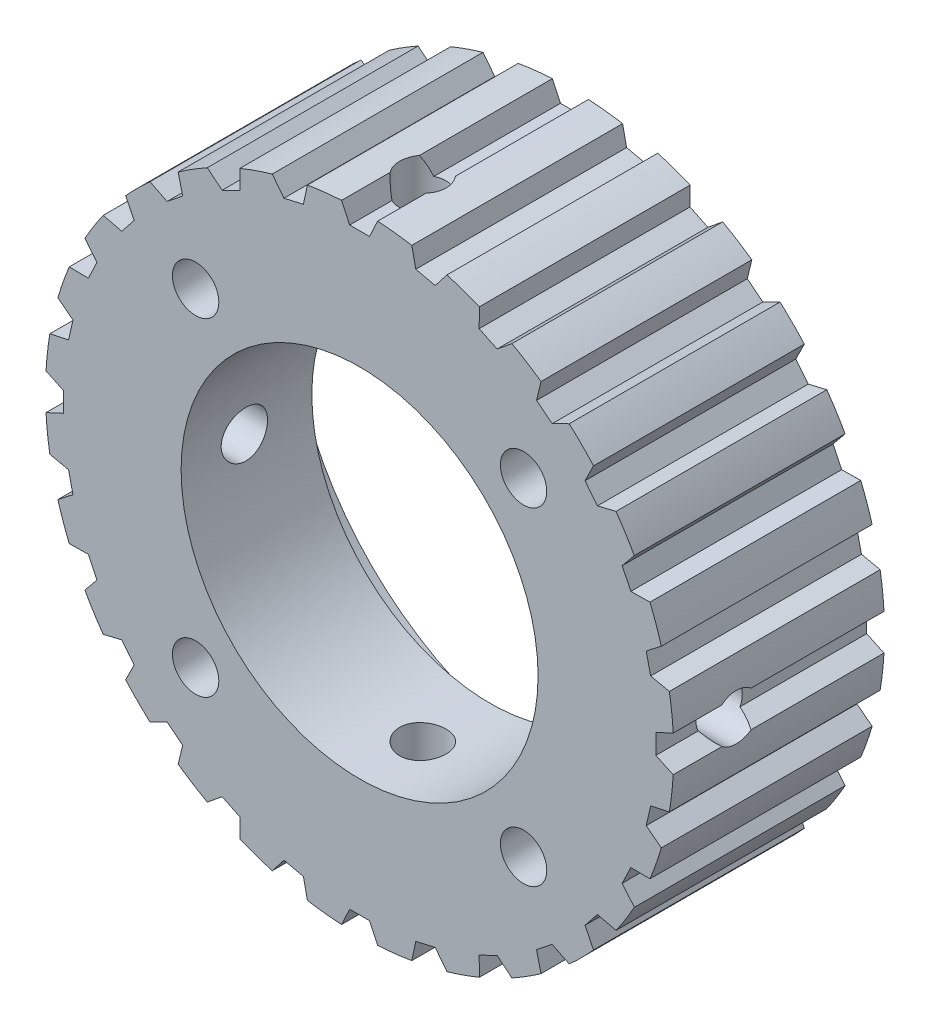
SolidWorks part; units mm, degrees
ref_plane "Front Plane" through (0, 0, 0) normal (0, 0, 1) x (1, 0, 0)
ref_plane "Top Plane" through (0, 0, 0) normal (0, 1, 0) x (1, 0, 0)
ref_plane "Right Plane" through (0, 0, 0) normal (1, 0, 0) x (0, 0, -1)
ref_plane "Plane1" through (0, 0, 0) normal (0, -1, 0) x (1, 0, 0)
sketch "Sketch1" plane through (0, 0, 0) normal (0, -1, 0) x (1, 0, 0)
  line L0 (22.35, 15) -> (0, 15)
  line L1 (0, 15) -> (0, 0)
  line L2 (0, 0) -> (22.35, 0)
  line L3 (22.35, 0) -> (22.35, 15)
  line L4 (0, 15) -> (0, 0) construction
revolve "Revolve1" add sketch "Sketch1" angle 360 about L4
sketch "Sketch2" plane through (0, 0, 15) normal (0, 0, 1) x (1, 0, 0)
  line L0 (8.5255, 20.6601) -> (8.5086, 19.2995)
  line L1 (8.5086, 19.2995) -> (10.5043, 19.2746)
  line L2 (10.5043, 19.2746) -> (10.8371, 19.5469)
  arc A0 (10.8371, 19.5469) -> (8.5255, 20.6601) centre (0, 0) ccw
extrude "Cut-Extrude1" cut sketch "Sketch2" against normal through all
sketch "Sketch3" plane through (0, 0, 15) normal (0, 0, 1) x (1, 0, 0)
  line L0 (12.9091, 18.245) -> (12.5898, 16.9223)
  line L1 (12.5898, 16.9223) -> (13.6965, 16.0397)
  line L2 (13.6965, 16.0397) -> (14.915, 16.6453)
  arc A0 (14.915, 16.6453) -> (12.9091, 18.245) centre (0, 0) ccw
extrude "Cut-Extrude2" cut sketch "Sketch3" against normal through all
sketch "Sketch4" plane through (0, 0, 15) normal (0, 0, 1) x (1, 0, 0)
  line L0 (16.6453, 14.915) -> (16.0397, 13.6965)
  line L1 (16.0397, 13.6965) -> (16.9223, 12.5898)
  line L2 (16.9223, 12.5898) -> (18.245, 12.9091)
  arc A0 (18.245, 12.9091) -> (16.6453, 14.915) centre (0, 0) ccw
extrude "Cut-Extrude3" cut sketch "Sketch4" against normal through all
sketch "Sketch5" plane through (0, 0, 15) normal (0, 0, 1) x (1, 0, 0)
  line L0 (19.5469, 10.8371) -> (19.2746, 10.5043)
  line L1 (19.2746, 10.5043) -> (19.2995, 8.5086)
  line L2 (19.2995, 8.5086) -> (20.6601, 8.5255)
  arc A0 (20.6601, 8.5255) -> (19.5469, 10.8371) centre (0, 0) ccw
extrude "Cut-Extrude4" cut sketch "Sketch5" against normal through all
sketch "Sketch6" plane through (0, 0, 15) normal (0, 0, 1) x (1, 0, 0)
  line L0 (21.4683, 6.2158) -> (20.394, 5.3808)
  line L1 (20.394, 5.3808) -> (20.709, 4.0007)
  line L2 (20.709, 4.0007) -> (22.0392, 3.7145)
  arc A0 (22.0392, 3.7145) -> (21.4683, 6.2158) centre (0, 0) ccw
extrude "Cut-Extrude5" cut sketch "Sketch6" against normal through all
sketch "Sketch7" plane through (0, 0, 15) normal (0, 0, 1) x (1, 0, 0)
  line L0 (22.3132, 1.2828) -> (21.08, 0.7078)
  line L1 (21.08, 0.7078) -> (21.08, -0.7078)
  line L2 (21.08, -0.7078) -> (22.3132, -1.2828)
  arc A0 (22.3132, -1.2828) -> (22.3132, 1.2828) centre (0, 0) ccw
extrude "Cut-Extrude6" cut sketch "Sketch7" against normal through all
sketch "Sketch8" plane through (0, 0, 15) normal (0, 0, 1) x (1, 0, 0)
  line L0 (22.0392, -3.7145) -> (20.709, -4.0007)
  line L1 (20.709, -4.0007) -> (20.394, -5.3808)
  line L2 (20.394, -5.3808) -> (21.4683, -6.2158)
  arc A0 (21.4683, -6.2158) -> (22.0392, -3.7145) centre (0, 0) ccw
extrude "Cut-Extrude7" cut sketch "Sketch8" against normal through all
sketch "Sketch9" plane through (0, 0, 15) normal (0, 0, 1) x (1, 0, 0)
  line L0 (20.6601, -8.5255) -> (19.2995, -8.5086)
  line L1 (19.2995, -8.5086) -> (19.2746, -10.5043)
  line L2 (19.2746, -10.5043) -> (19.5469, -10.8371)
  arc A0 (19.5469, -10.8371) -> (20.6601, -8.5255) centre (0, 0) ccw
extrude "Cut-Extrude8" cut sketch "Sketch9" against normal through all
sketch "Sketch10" plane through (0, 0, 15) normal (0, 0, 1) x (1, 0, 0)
  line L0 (18.245, -12.9091) -> (16.9223, -12.5898)
  line L1 (16.9223, -12.5898) -> (16.0397, -13.6965)
  line L2 (16.0397, -13.6965) -> (16.6453, -14.915)
  arc A0 (16.6453, -14.915) -> (18.245, -12.9091) centre (0, 0) ccw
extrude "Cut-Extrude9" cut sketch "Sketch10" against normal through all
sketch "Sketch11" plane through (0, 0, 15) normal (0, 0, 1) x (1, 0, 0)
  line L0 (14.915, -16.6453) -> (13.6965, -16.0397)
  line L1 (13.6965, -16.0397) -> (12.5898, -16.9223)
  line L2 (12.5898, -16.9223) -> (12.9091, -18.245)
  arc A0 (12.9091, -18.245) -> (14.915, -16.6453) centre (0, 0) ccw
extrude "Cut-Extrude10" cut sketch "Sketch11" against normal through all
sketch "Sketch12" plane through (0, 0, 15) normal (0, 0, 1) x (1, 0, 0)
  line L0 (10.8371, -19.5469) -> (10.5043, -19.2746)
  line L1 (10.5043, -19.2746) -> (8.5086, -19.2995)
  line L2 (8.5086, -19.2995) -> (8.5255, -20.6601)
  arc A0 (8.5255, -20.6601) -> (10.8371, -19.5469) centre (0, 0) ccw
extrude "Cut-Extrude11" cut sketch "Sketch12" against normal through all
sketch "Sketch13" plane through (0, 0, 15) normal (0, 0, 1) x (1, 0, 0)
  line L0 (6.2158, -21.4683) -> (5.3808, -20.394)
  line L1 (5.3808, -20.394) -> (4.0007, -20.709)
  line L2 (4.0007, -20.709) -> (3.7145, -22.0392)
  arc A0 (3.7145, -22.0392) -> (6.2158, -21.4683) centre (0, 0) ccw
extrude "Cut-Extrude12" cut sketch "Sketch13" against normal through all
sketch "Sketch14" plane through (0, 0, 15) normal (0, 0, 1) x (1, 0, 0)
  line L0 (1.2828, -22.3132) -> (0.7078, -21.08)
  line L1 (0.7078, -21.08) -> (-0.7078, -21.08)
  line L2 (-0.7078, -21.08) -> (-1.2828, -22.3132)
  arc A0 (-1.2828, -22.3132) -> (1.2828, -22.3132) centre (0, 0) ccw
extrude "Cut-Extrude13" cut sketch "Sketch14" against normal through all
sketch "Sketch15" plane through (0, 0, 15) normal (0, 0, 1) x (1, 0, 0)
  line L0 (-3.7145, -22.0392) -> (-4.0007, -20.709)
  line L1 (-4.0007, -20.709) -> (-5.3808, -20.394)
  line L2 (-5.3808, -20.394) -> (-6.2158, -21.4683)
  arc A0 (-6.2158, -21.4683) -> (-3.7145, -22.0392) centre (0, 0) ccw
extrude "Cut-Extrude14" cut sketch "Sketch15" against normal through all
sketch "Sketch16" plane through (0, 0, 15) normal (0, 0, 1) x (1, 0, 0)
  line L0 (-8.5255, -20.6601) -> (-8.5086, -19.2995)
  line L1 (-8.5086, -19.2995) -> (-10.5043, -19.2746)
  line L2 (-10.5043, -19.2746) -> (-10.8371, -19.5469)
  arc A0 (-10.8371, -19.5469) -> (-8.5255, -20.6601) centre (0, 0) ccw
extrude "Cut-Extrude15" cut sketch "Sketch16" against normal through all
sketch "Sketch17" plane through (0, 0, 15) normal (0, 0, 1) x (1, 0, 0)
  line L0 (-12.9091, -18.245) -> (-12.5898, -16.9223)
  line L1 (-12.5898, -16.9223) -> (-13.6965, -16.0397)
  line L2 (-13.6965, -16.0397) -> (-14.915, -16.6453)
  arc A0 (-14.915, -16.6453) -> (-12.9091, -18.245) centre (0, 0) ccw
extrude "Cut-Extrude16" cut sketch "Sketch17" against normal through all
sketch "Sketch18" plane through (0, 0, 15) normal (0, 0, 1) x (1, 0, 0)
  line L0 (-16.6453, -14.915) -> (-16.0397, -13.6965)
  line L1 (-16.0397, -13.6965) -> (-16.9223, -12.5898)
  line L2 (-16.9223, -12.5898) -> (-18.245, -12.9091)
  arc A0 (-18.245, -12.9091) -> (-16.6453, -14.915) centre (0, 0) ccw
extrude "Cut-Extrude17" cut sketch "Sketch18" against normal through all
sketch "Sketch19" plane through (0, 0, 15) normal (0, 0, 1) x (1, 0, 0)
  line L0 (-19.5469, -10.8371) -> (-19.2746, -10.5043)
  line L1 (-19.2746, -10.5043) -> (-19.2995, -8.5086)
  line L2 (-19.2995, -8.5086) -> (-20.6601, -8.5255)
  arc A0 (-20.6601, -8.5255) -> (-19.5469, -10.8371) centre (0, 0) ccw
extrude "Cut-Extrude18" cut sketch "Sketch19" against normal through all
sketch "Sketch20" plane through (0, 0, 15) normal (0, 0, 1) x (1, 0, 0)
  line L0 (-21.4683, -6.2158) -> (-20.394, -5.3808)
  line L1 (-20.394, -5.3808) -> (-20.709, -4.0007)
  line L2 (-20.709, -4.0007) -> (-22.0392, -3.7145)
  arc A0 (-22.0392, -3.7145) -> (-21.4683, -6.2158) centre (0, 0) ccw
extrude "Cut-Extrude19" cut sketch "Sketch20" against normal through all
sketch "Sketch21" plane through (0, 0, 15) normal (0, 0, 1) x (1, 0, 0)
  line L0 (-22.3132, -1.2828) -> (-21.08, -0.7078)
  line L1 (-21.08, -0.7078) -> (-21.08, 0.7078)
  line L2 (-21.08, 0.7078) -> (-22.3132, 1.2828)
  arc A0 (-22.3132, 1.2828) -> (-22.3132, -1.2828) centre (0, 0) ccw
extrude "Cut-Extrude20" cut sketch "Sketch21" against normal through all
sketch "Sketch22" plane through (0, 0, 15) normal (0, 0, 1) x (1, 0, 0)
  line L0 (-22.0392, 3.7145) -> (-20.709, 4.0007)
  line L1 (-20.709, 4.0007) -> (-20.394, 5.3808)
  line L2 (-20.394, 5.3808) -> (-21.4683, 6.2158)
  arc A0 (-21.4683, 6.2158) -> (-22.0392, 3.7145) centre (0, 0) ccw
extrude "Cut-Extrude21" cut sketch "Sketch22" against normal through all
sketch "Sketch23" plane through (0, 0, 15) normal (0, 0, 1) x (1, 0, 0)
  line L0 (-20.6601, 8.5255) -> (-19.2995, 8.5086)
  line L1 (-19.2995, 8.5086) -> (-19.2746, 10.5043)
  line L2 (-19.2746, 10.5043) -> (-19.5469, 10.8371)
  arc A0 (-19.5469, 10.8371) -> (-20.6601, 8.5255) centre (0, 0) ccw
extrude "Cut-Extrude22" cut sketch "Sketch23" against normal through all
sketch "Sketch24" plane through (0, 0, 15) normal (0, 0, 1) x (1, 0, 0)
  line L0 (-18.245, 12.9091) -> (-16.9223, 12.5898)
  line L1 (-16.9223, 12.5898) -> (-16.0397, 13.6965)
  line L2 (-16.0397, 13.6965) -> (-16.6453, 14.915)
  arc A0 (-16.6453, 14.915) -> (-18.245, 12.9091) centre (0, 0) ccw
extrude "Cut-Extrude23" cut sketch "Sketch24" against normal through all
sketch "Sketch25" plane through (0, 0, 15) normal (0, 0, 1) x (1, 0, 0)
  line L0 (-14.915, 16.6453) -> (-13.6965, 16.0397)
  line L1 (-13.6965, 16.0397) -> (-12.5898, 16.9223)
  line L2 (-12.5898, 16.9223) -> (-12.9091, 18.245)
  arc A0 (-12.9091, 18.245) -> (-14.915, 16.6453) centre (0, 0) ccw
extrude "Cut-Extrude24" cut sketch "Sketch25" against normal through all
sketch "Sketch26" plane through (0, 0, 15) normal (0, 0, 1) x (1, 0, 0)
  line L0 (-10.8371, 19.5469) -> (-10.5043, 19.2746)
  line L1 (-10.5043, 19.2746) -> (-8.5086, 19.2995)
  line L2 (-8.5086, 19.2995) -> (-8.5255, 20.6601)
  arc A0 (-8.5255, 20.6601) -> (-10.8371, 19.5469) centre (0, 0) ccw
extrude "Cut-Extrude25" cut sketch "Sketch26" against normal through all
sketch "Sketch27" plane through (0, 0, 15) normal (0, 0, 1) x (1, 0, 0)
  line L0 (-6.2158, 21.4683) -> (-5.3808, 20.394)
  line L1 (-5.3808, 20.394) -> (-4.0007, 20.709)
  line L2 (-4.0007, 20.709) -> (-3.7145, 22.0392)
  arc A0 (-3.7145, 22.0392) -> (-6.2158, 21.4683) centre (0, 0) ccw
extrude "Cut-Extrude26" cut sketch "Sketch27" against normal through all
sketch "Sketch28" plane through (0, 0, 15) normal (0, 0, 1) x (1, 0, 0)
  line L0 (-1.2828, 22.3132) -> (-0.7078, 21.08)
  line L1 (-0.7078, 21.08) -> (0.7078, 21.08)
  line L2 (0.7078, 21.08) -> (1.2828, 22.3132)
  arc A0 (1.2828, 22.3132) -> (-1.2828, 22.3132) centre (0, 0) ccw
extrude "Cut-Extrude27" cut sketch "Sketch28" against normal through all
sketch "Sketch29" plane through (0, 0, 15) normal (0, 0, 1) x (1, 0, 0)
  line L0 (3.7145, 22.0392) -> (4.0007, 20.709)
  line L1 (4.0007, 20.709) -> (5.3808, 20.394)
  line L2 (5.3808, 20.394) -> (6.2158, 21.4683)
  arc A0 (6.2158, 21.4683) -> (3.7145, 22.0392) centre (0, 0) ccw
extrude "Cut-Extrude28" cut sketch "Sketch29" against normal through all
draft "Draft1" type of draft neutral plane draft angle 25 faces to draft 1 parameters "D1"=25
draft "Draft2" type of draft neutral plane draft angle 25 faces to draft 1 parameters "D1"=25
draft "Draft3" type of draft neutral plane draft angle 25 faces to draft 1 parameters "D1"=25
draft "Draft4" type of draft neutral plane draft angle 25 faces to draft 1 parameters "D1"=25
draft "Draft5" type of draft neutral plane draft angle 25 faces to draft 1 parameters "D1"=25
draft "Draft6" type of draft neutral plane draft angle 25 faces to draft 1 parameters "D1"=25
draft "Draft7" type of draft neutral plane draft angle 25 faces to draft 1 parameters "D1"=25
draft "Draft8" type of draft neutral plane draft angle 25 faces to draft 1 parameters "D1"=25
hole_wizard "Hole1" positions "Sketch31" profile "Sketch30" legacy
sketch "Sketch31" plane through (0, 0, 0) normal (0, 0, -1) x (-1, 0, 0)
  point P0 (0, 0)
sketch "Sketch30" plane through (0, 0, 0) normal (1, 0, 0) x (0, 1, 0)
  line L0 (0, 0) -> (0, 15)
  line L1 (0, 15) -> (12.7, 15)
  line L2 (12.7, 15) -> (12.7, 5.7)
  line L3 (12.7, 5.7) -> (20, 5.7)
  line L4 (20, 5.7) -> (20, 0)
  line L5 (20, 0) -> (0, 0)
  line L6 (0, 110) -> (0, -10) construction
  dimension "Diameter" = 25.4
  dimension "Depth" = 15
  dimension "C-Bore Diameter" = 40
  dimension "C-Bore Depth" = 5.7
ref_plane "Plane2" through (12.5924, 0, 0) normal (-1, 0, 0) x (0, 0, 1)
hole_wizard "#4 Clearance Hole1" positions "Sketch33" profile "Sketch32" hole size "#4" standard "ANSI Inch"
sketch "Sketch33" plane through (12.5924, 0, 0) normal (-1, 0, 0) x (0, 0, 1)
  point P0 (10.5, 0)
sketch "Sketch32" plane through (12.5924, 0, 10.5) normal (0, 1, 0) x (0, 0, 1)
  line L0 (0, 0) -> (0, 9.7208)
  line L1 (0, 9.7208) -> (1.65, 9.7208)
  line L2 (1.65, 9.7208) -> (1.65, 0)
  line L5 (1.65, 0) -> (0, 0)
  line L11 (0, -6.35) -> (0, 107.95) construction
  dimension "Thru Hole Dia." = 3.3
  dimension "Thru Hole Depth" = 9.7208
ref_plane "Plane3" through (0, -12.5924, 0) normal (0, 1, 0) x (1, 0, 0)
hole_wizard "#4 Clearance Hole2" positions "Sketch35" profile "Sketch34" hole size "#4" standard "ANSI Inch"
sketch "Sketch35" plane through (0, -12.5924, 0) normal (0, 1, 0) x (1, 0, 0)
  point P0 (0, -10.5)
sketch "Sketch34" plane through (0, -12.5924, 10.5) normal (1, 0, 0) x (0, 0, 1)
  line L0 (0, 0) -> (0, 9.7208)
  line L1 (0, 9.7208) -> (1.65, 9.7208)
  line L2 (1.65, 9.7208) -> (1.65, 0)
  line L5 (1.65, 0) -> (0, 0)
  line L11 (0, -6.35) -> (0, 107.95) construction
  dimension "Thru Hole Dia." = 3.3
  dimension "Thru Hole Depth" = 9.7208
ref_plane "Plane4" through (-12.5924, 0, 0) normal (1, 0, 0) x (0, 0, -1)
hole_wizard "#4 Clearance Hole3" positions "Sketch37" profile "Sketch36" hole size "#4" standard "ANSI Inch"
sketch "Sketch37" plane through (-12.5924, 0, 0) normal (1, 0, 0) x (0, 0, -1)
  point P0 (-10.5, 0)
sketch "Sketch36" plane through (-12.5924, 0, 10.5) normal (0, 1, 0) x (0, 0, -1)
  line L0 (0, 0) -> (0, 9.7208)
  line L1 (0, 9.7208) -> (1.65, 9.7208)
  line L2 (1.65, 9.7208) -> (1.65, 0)
  line L5 (1.65, 0) -> (0, 0)
  line L11 (0, -6.35) -> (0, 107.95) construction
  dimension "Thru Hole Dia." = 3.3
  dimension "Thru Hole Depth" = 9.7208
ref_plane "Plane5" through (0, 12.5924, 0) normal (0, -1, 0) x (-1, 0, 0)
hole_wizard "#4 Clearance Hole4" positions "Sketch39" profile "Sketch38" hole size "#4" standard "ANSI Inch"
sketch "Sketch39" plane through (0, 12.5924, 0) normal (0, -1, 0) x (-1, 0, 0)
  point P0 (0, -10.5)
sketch "Sketch38" plane through (0, 12.5924, 10.5) normal (1, 0, 0) x (0, 0, -1)
  line L0 (0, 0) -> (0, 9.7208)
  line L1 (0, 9.7208) -> (1.65, 9.7208)
  line L2 (1.65, 9.7208) -> (1.65, 0)
  line L5 (1.65, 0) -> (0, 0)
  line L11 (0, -6.35) -> (0, 107.95) construction
  dimension "Thru Hole Dia." = 3.3
  dimension "Thru Hole Depth" = 9.7208
hole_wizard "#4 Clearance Hole5" positions "Sketch41" profile "Sketch40" hole size "#4" standard "ANSI Inch"
sketch "Sketch41" plane through (0, 0, 15) normal (0, 0, 1) x (1, 0, 0)
  point P0 (11.6673, -11.6673)
  point P1 (-11.6673, -11.6673)
  point P2 (-11.6673, 11.6673)
  point P3 (11.6673, 11.6673)
sketch "Sketch40" plane through (11.6673, -11.6673, 15) normal (1, 0, 0) x (0, -1, 0)
  line L0 (0, 0) -> (0, 15)
  line L1 (0, 15) -> (1.65, 15)
  line L2 (1.65, 15) -> (1.65, 0)
  line L5 (1.65, 0) -> (0, 0)
  line L11 (0, -6.35) -> (0, 107.95) construction
  dimension "Thru Hole Dia." = 3.3
  dimension "Thru Hole Depth" = 15
